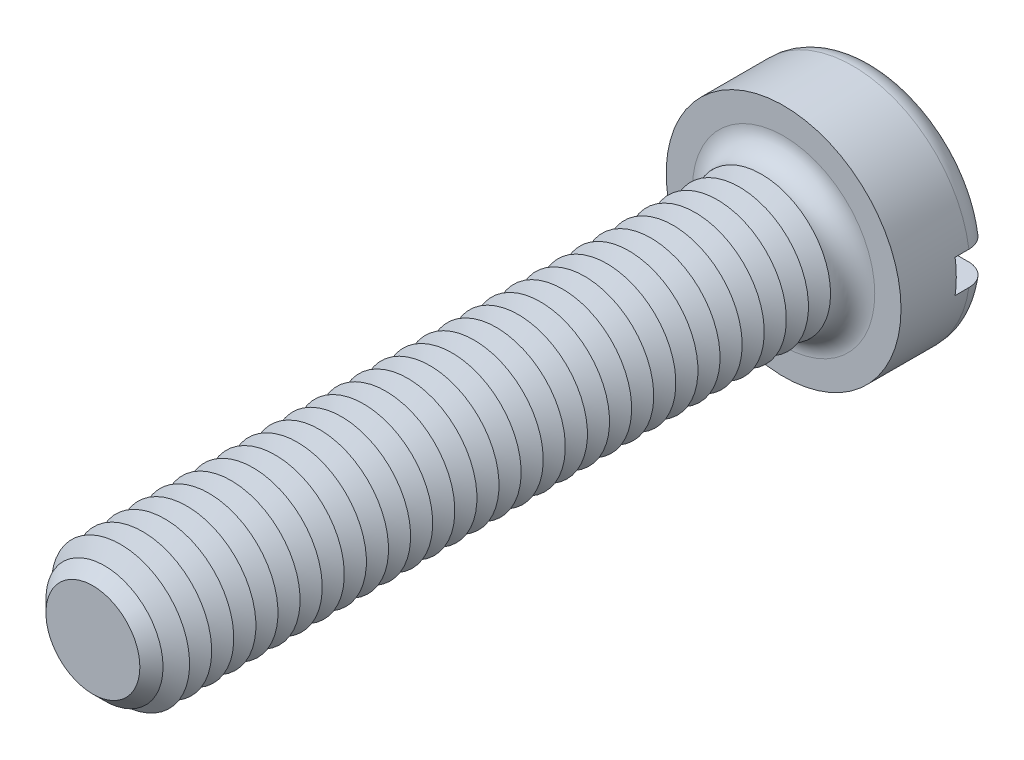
SolidWorks part; units mm, degrees
ref_plane "Front Plane" through (0, 0, 0) normal (0, 0, 1) x (1, 0, 0)
ref_plane "Top Plane" through (0, 0, 0) normal (0, 1, 0) x (1, 0, 0)
ref_plane "Right Plane" through (0, 0, 0) normal (1, 0, 0) x (0, 0, -1)
sketch "Sketch3" plane through (0, 0, 0) normal (0, 0, 1) x (1, 0, 0)
  circle A0 centre (0, 0) radius 4.25
  dimension "D1" = 8.5
extrude "Boss-Extrude2" add sketch "Sketch3" against normal blind 3.3
sketch "Sketch4" plane through (0, 0, 0) normal (0, 0, 1) x (1, 0, 0)
  circle A0 centre (0, 0) radius 2.5
  dimension "D1" = 5
extrude "Boss-Extrude3" add sketch "Sketch4" along normal blind 25
fillet "Fillet1" radius 0.8 2 edges at (4.25, 0, -3.3) (2.5, 0, 0)
chamfer "Chamfer1" distance 0.8 angle 45 1 edges at (2.5, 0, 25)
sketch "Sketch5" plane through (0, 0, 0) normal (1, 0, 0) x (0, 0, -1)
  line L0 (1.6944, 0) -> (-7.6738, 0) construction
sketch "Sketch6" plane through (0, 0, 0) normal (1, 0, 0) x (0, 0, -1)
  line L0 (-0.8, 2.5) -> (-1.2, 1.8072)
  line L1 (-1.2, 1.8072) -> (-1.6, 2.5)
  line L2 (-0.8, 2.5) -> (-24.2, 2.5) construction
  line L3 (-1.6, 2.5) -> (-0.8, 2.5)
  dimension "D1" = 0.8
revolve "Cut-Revolve1" cut sketch "Sketch6" angle 360 about L0
pattern_linear "LPattern1" count 30 spacing 0.8 along (0, 0, 1) of "Cut-Revolve1"
sketch "Sketch8" plane through (0, 0, -3.3) normal (0, 0, -1) x (-1, 0, 0)
  line L1 (4.25, -0.6) -> (-4.25, -0.6)
  line L2 (4.25, -0.6) -> (4.25, 0.6)
  line L3 (4.25, 0.6) -> (-4.25, 0.6)
  line L4 (-4.25, -0.6) -> (-4.25, 0.6)
  line L5 (4.25, -0.6) -> (-4.25, 0.6) construction
  line L6 (4.25, 0.6) -> (-4.25, -0.6) construction
  point P0 (0, 0)
  dimension "D1" = 8.5
  dimension "D2" = 1.2
extrude "Cut-Extrude1" cut sketch "Sketch8" against normal blind 1.3
